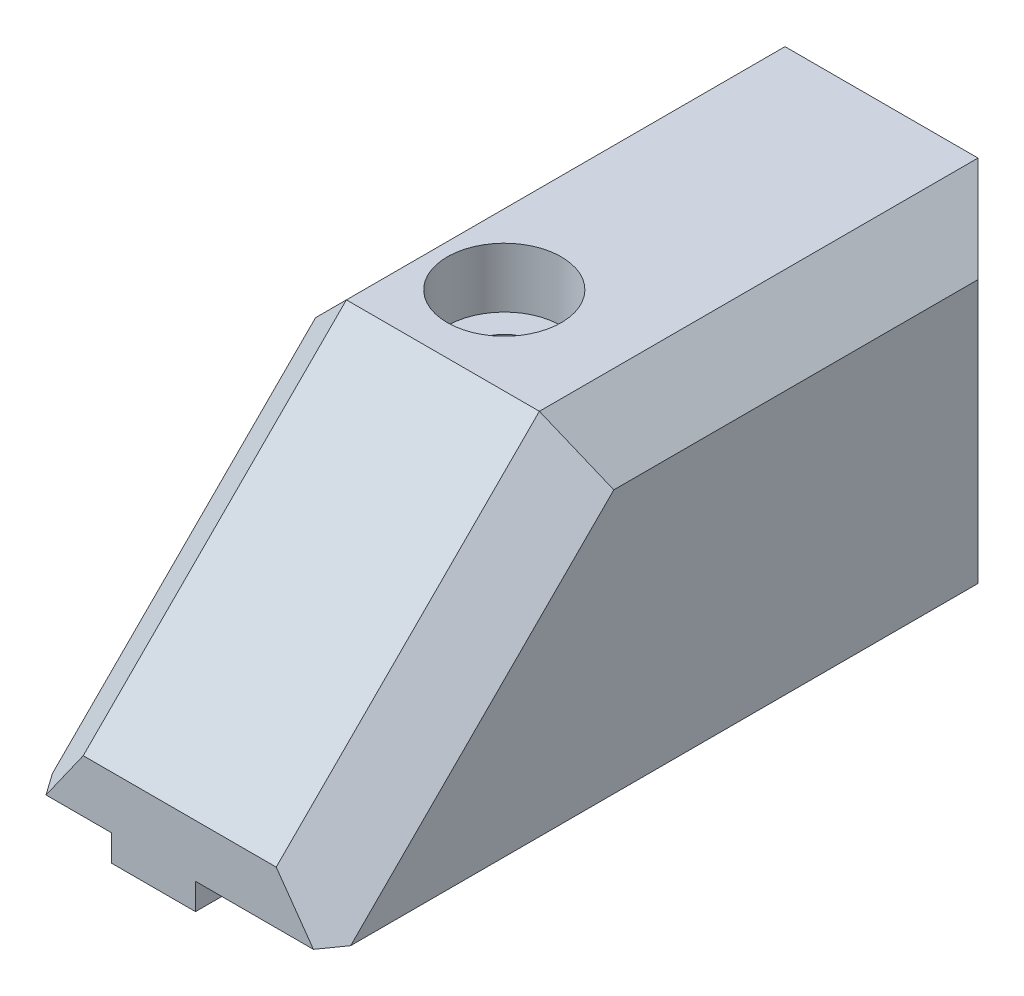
SolidWorks part; units mm, degrees
ref_plane "Aufriss" through (0, 0, 0) normal (0, 0, 1) x (1, 0, 0)
ref_plane "Grundriss" through (0, 0, 0) normal (0, 1, 0) x (1, 0, 0)
ref_plane "Seitenriss" through (0, 0, 0) normal (1, 0, 0) x (0, 0, -1)
sketch "Skizze1" plane through (0, 0, 0) normal (0, 1, 0) x (1, 0, 0)
  line L1 (-8.5, -20) -> (8.5, -20)
  line L2 (-8.5, -20) -> (-8.5, 20)
  line L3 (-8.5, 20) -> (8.5, 20)
  line L4 (8.5, -20) -> (8.5, 20)
  line L5 (-8.5, -20) -> (8.5, 20) construction
  line L6 (-8.5, 20) -> (8.5, -20) construction
  point P0 (0, 0)
  dimension "D1" = 17
  dimension "D2" = 40
extrude "Aufsatz-Linear austragen1" add sketch "Skizze1" along normal blind 18
sketch "Skizze2" plane through (0, 0, 0) normal (0, -1, 0) x (1, 0, 0)
  line L0 (-8.5, 20) -> (8.5, 20) construction
  line L1 (-3.9, 20) -> (0.9, 20)
  line L2 (-3.9, 20) -> (-3.9, -20)
  line L3 (-3.9, -20) -> (0.9, -20)
  line L4 (0.9, 20) -> (0.9, -20)
  line L5 (8.5, -20) -> (-8.5, -20) construction
  line L6 (8.5, 20) -> (8.5, -20) construction
  point P8 (-1.5, 20)
  dimension "D1" = 4.8
  dimension "D2" = 10
extrude "Aufsatz-Linear austragen2" add sketch "Skizze2" along normal blind 1.5
hole_wizard "Stirnsenkung für M3 Zylinderschraube mit Innensechskant1" positions "Skizze3" profile "Skizze4" counterbore size "M3" standard "DIN"
sketch "Skizze3" plane through (0, 18, 0) normal (0, 1, 0) x (1, 0, 0)
  line L0 (8.5, -20) -> (8.5, 20) construction
  point P0 (-1.5, 0)
  dimension "D1" = 10
sketch "Skizze4" plane through (-1.5, 18, 0) normal (1, 0, 0) x (0, 0, 1)
  line L0 (0, 0) -> (0, 19.5)
  line L1 (0, 19.5) -> (1.7, 19.5)
  line L3 (1.7, 19.5) -> (1.7, 3.4)
  line L4 (1.7, 3.4) -> (3.25, 3.4)
  line L5 (3.25, 3.4) -> (3.25, 0)
  line L7 (3.25, 0) -> (0, 0)
  line L11 (0, -6.35) -> (0, 107.95) construction
  dimension "Bohrerdurchmesser" = 3.4
  dimension "Bohrungstiefe" = 19.5
  dimension "Senkdurchmesser2" = 6.5
  dimension "Senktiefe2" = 3.4
hole_wizard "Ø6.0 (5.6) Durchmesser Bohrung1" positions "Skizze5" profile "Skizze6" hole size "Ø6.0" standard "DIN"
sketch "Skizze5" plane through (0, 0, -20) normal (0, 0, -1) x (-1, 0, 0)
  line L0 (3.9, 0) -> (8.5, 0) construction
  line L1 (1.5, -1.5) -> (1.5, 12) construction
  line L2 (3.9, -1.5) -> (-0.9, -1.5) construction
  point P0 (1.5, 12)
  dimension "D1" = 12
sketch "Skizze6" plane through (-1.5, 12, -20) normal (1, 0, 0) x (0, 1, 0)
  line L0 (0, 0) -> (0, 15)
  line L1 (0, 15) -> (2.8, 15)
  line L2 (2.8, 15) -> (2.8, 0)
  line L5 (2.8, 0) -> (0, 0)
  line L10 (0, 15) -> (-2.8, 15) construction
  line L11 (0, -6.35) -> (0, 107.95) construction
  dimension "Bohrerdurchmesser" = 5.6
  dimension "Bohrungstiefe" = 15
  dimension "Spitzenwinkel" = 180
sketch "Skizze9" plane through (8.5, 0, 0) normal (1, 0, 0) x (0, 0, -1)
  line L0 (-20, 3) -> (-5, 18)
  line L1 (-20, 18) -> (-20, 0) construction
  line L2 (-20, 18) -> (20, 18) construction
  line L3 (-5, 18) -> (-20, 18)
  line L4 (-20, 18) -> (-20, 3)
  line L5 (-20, 0) -> (20, 0) construction
  dimension "D1" = 3
  dimension "D2" = 45
extrude "Schnitt-Linear austragen1" cut sketch "Skizze9" against normal through all
chamfer "Fase1" distance 3 angle 45 6 edges at (-8.5, 9, -20) (-8.5, 10.5, 12.5) (-8.5, 18, -7.5) (8.5, 9, -20) (8.5, 10.5, 12.5) (8.5, 18, -7.5)
